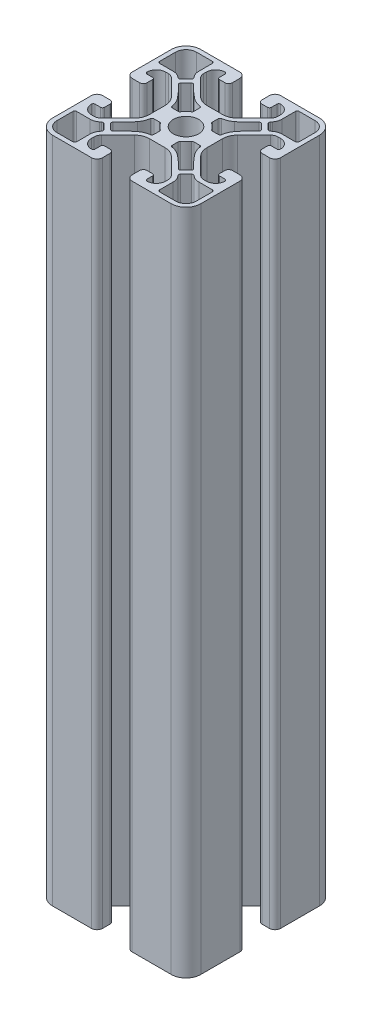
SolidWorks part; units mm, degrees
other "2018_07_20__14-51-15-564"
ref_plane "Ebene vorne" through (0, 0, 0) normal (0, 0, 1) x (1, 0, 0)
ref_plane "Ebene oben" through (0, 0, 0) normal (0, 1, 0) x (1, 0, 0)
ref_plane "Ebene rechts" through (0, 0, 0) normal (1, 0, 0) x (0, 0, -1)
imported_body "Importiert1"
sketch "Skizze1" plane through (0, 1500, 0) normal (0, 1, 0) x (1, 0, 0)
  line L1 (-21.9225, -25.1362) -> (21.9225, -25.1362)
  line L2 (-21.9225, -25.1362) -> (-21.9225, 25.1362)
  line L3 (-21.9225, 25.1362) -> (21.9225, 25.1362)
  line L4 (21.9225, -25.1362) -> (21.9225, 25.1362)
  line L5 (-21.9225, -25.1362) -> (21.9225, 25.1362) construction
  line L6 (-21.9225, 25.1362) -> (21.9225, -25.1362) construction
  point P0 (0, 0)
extrude "Schnitt-Linear austragen1" cut sketch "Skizze1" against normal offset from surface (2820 mm away) 180
